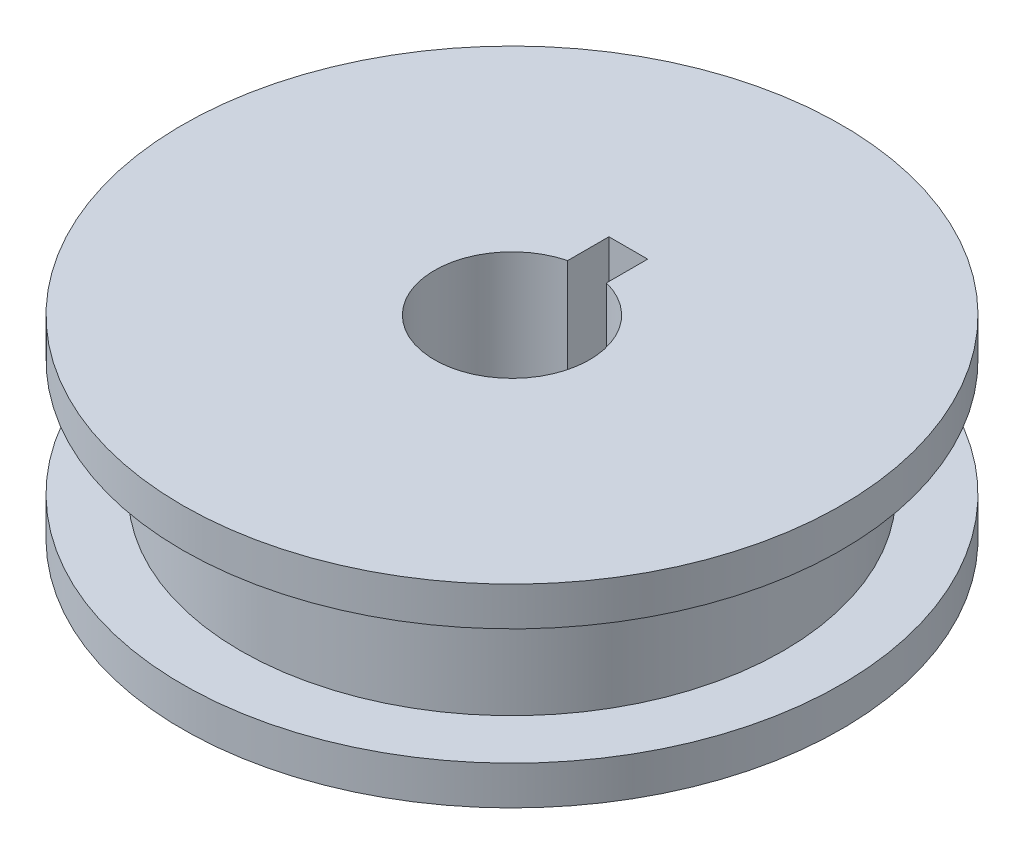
SolidWorks part; units mm, degrees
ref_plane "Front Plane" through (0, 0, 0) normal (0, 0, 1) x (1, 0, 0)
ref_plane "Top Plane" through (0, 0, 0) normal (0, 1, 0) x (1, 0, 0)
ref_plane "Right Plane" through (0, 0, 0) normal (1, 0, 0) x (0, 0, -1)
sketch "Sketch1" plane through (0, 0, 0) normal (0, 1, 0) x (1, 0, 0)
  circle A0 centre (0, 0) radius 22.225
extrude "Boss-Extrude1" add sketch "Sketch1" along normal blind 3.175 and the other way blind 6.35
ref_plane "Plane1" through (0, 3.175, 0) normal (0, 1, 0) x (-1, 0, 0)
ref_plane "Plane2" through (0, -6.35, 0) normal (0, -1, 0) x (1, 0, 0)
sketch "Sketch2" plane through (0, -6.35, 0) normal (0, -1, 0) x (1, 0, 0)
  circle A0 centre (0, 0) radius 26.9875
extrude "Boss-Extrude2" add sketch "Sketch2" along normal blind 3.175
sketch "Sketch3" plane through (0, 3.175, 0) normal (0, 1, 0) x (-1, 0, 0)
  circle A0 centre (0, 0) radius 26.9875
extrude "Boss-Extrude3" add sketch "Sketch3" along normal blind 3.175
sketch "Sketch4" plane through (0, 0, 0) normal (0, 1, 0) x (1, 0, 0)
  circle A0 centre (0, 0) radius 6.35
extrude "Cut-Extrude1" cut sketch "Sketch4" against normal blind 54.737 and the other way blind 31.496
sketch "Sketch5" plane through (0, 6.35, 0) normal (0, 1, 0) x (-1, 0, 0)
  line L0 (0, -6.35) -> (0, -9.525) construction
  line L1 (-1.5875, -6.35) -> (-1.5875, -9.525)
  line L2 (1.5875, -6.35) -> (1.5875, -9.525)
  line L3 (1.5875, -6.35) -> (1.5875, -6.1484)
  line L4 (1.5875, -9.525) -> (-1.5875, -9.525)
  line L5 (-1.5875, -6.1484) -> (-1.5875, -6.35)
  circle A0 centre (0, 0) radius 6.35 construction
  arc A1 (-1.5875, -6.1484) -> (1.5875, -6.1484) centre (0, 0) ccw
  dimension "D1" = 3.175
  dimension "D2" = 1.5875
  dimension "D3" = 1.5875
extrude "Cut-Extrude2" cut sketch "Sketch5" against normal through all
